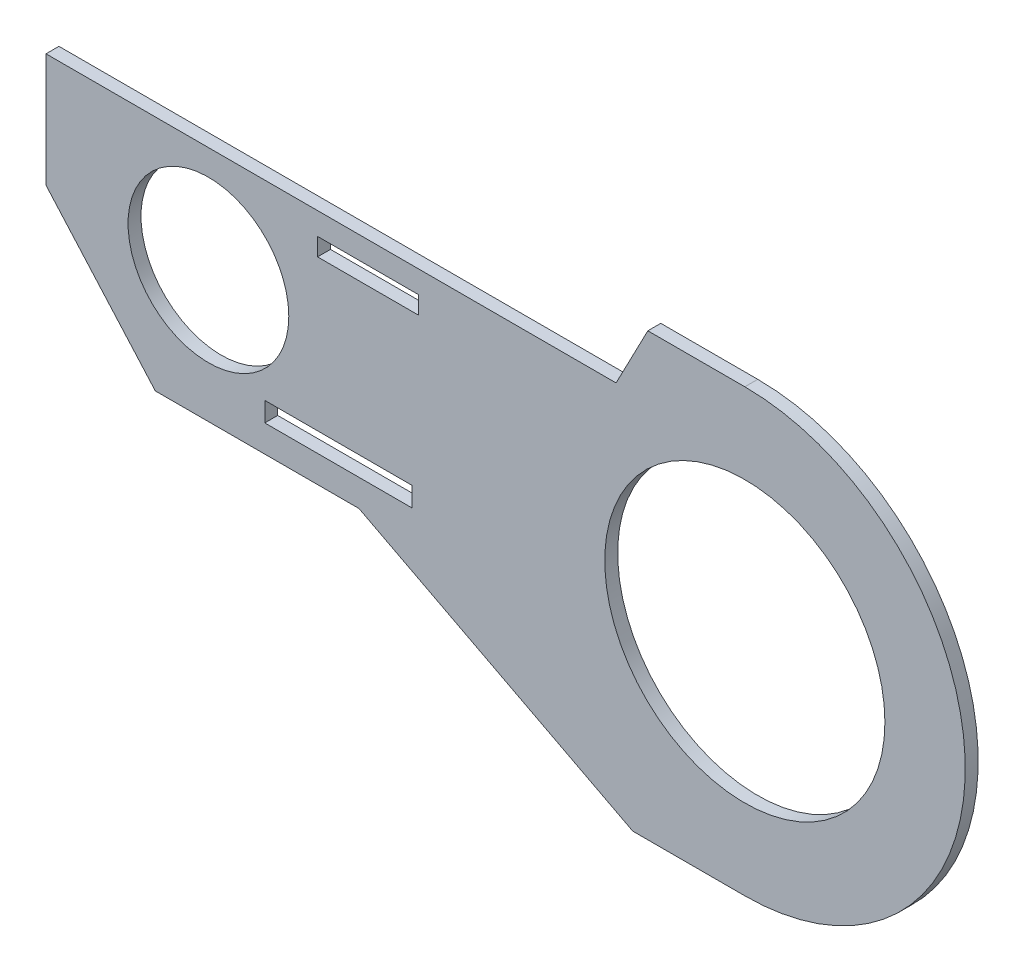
SolidWorks part; units mm, degrees
ref_plane "Front" through (0, 0, 0) normal (0, 0, 1) x (1, 0, 0)
ref_plane "Top" through (0, 0, 0) normal (0, 1, 0) x (1, 0, 0)
ref_plane "Right" through (0, 0, 0) normal (1, 0, 0) x (0, 0, -1)
other "Center of Mass"
sketch "Sketch1" plane through (0, 0, 0) normal (0, 0, 1) x (1, 0, 0)
  line L15 (0, 0) -> (256.094, -133.2902)
  line L16 (256.094, -133.2902) -> (360.8953, -133.2902)
  line L17 (360.8953, -133.2902) -> (360.8953, 279.056) construction
  line L18 (360.8953, 279.056) -> (270.1846, 279.056)
  line L19 (270.1846, 279.056) -> (240.4735, 221.9714)
  line L20 (240.4735, 221.9714) -> (-292.7281, 221.9714)
  line L21 (-292.7281, 221.9714) -> (-292.7281, 115.5003)
  line L22 (-292.7281, 115.5003) -> (-190.4898, 0)
  line L23 (-190.4898, 0) -> (0, 0)
  line L25 (-38.7361, 201.058) -> (55.6816, 201.058)
  line L26 (-38.7361, 201.058) -> (-38.7361, 184.4711)
  line L27 (-38.7361, 184.4711) -> (55.6816, 184.4711)
  line L28 (55.6816, 201.058) -> (55.6816, 184.4711)
  line L29 (-38.7361, 201.058) -> (55.6816, 184.4711) construction
  line L30 (-38.7361, 184.4711) -> (55.6816, 201.058) construction
  line L31 (-88.1033, 43.5665) -> (49.4157, 43.5665)
  line L32 (-88.1033, 43.5665) -> (-88.1033, 25.282)
  line L33 (-88.1033, 25.282) -> (49.4157, 25.282)
  line L34 (49.4157, 43.5665) -> (49.4157, 25.282)
  line L35 (-88.1033, 43.5665) -> (49.4157, 25.282) construction
  line L36 (-88.1033, 25.282) -> (49.4157, 43.5665) construction
  circle A1 centre (-140.8079, 122.8435) radius 75.1666
  circle A2 centre (360.8953, 72.8829) radius 131.0269
  arc A3 (360.8953, 279.056) -> (360.8953, -133.2902) centre (360.8953, 72.8829) cw
  point P3 (-19.3438, 34.4242)
  point P19 (8.4727, 192.7645)
  point P29 (0, 0)
  point P30 (355.0333, 72.8829)
extrude "Boss-Extrude1" add sketch "Sketch1" along normal blind 12.1
other "Center of Mass Reference Point1"
